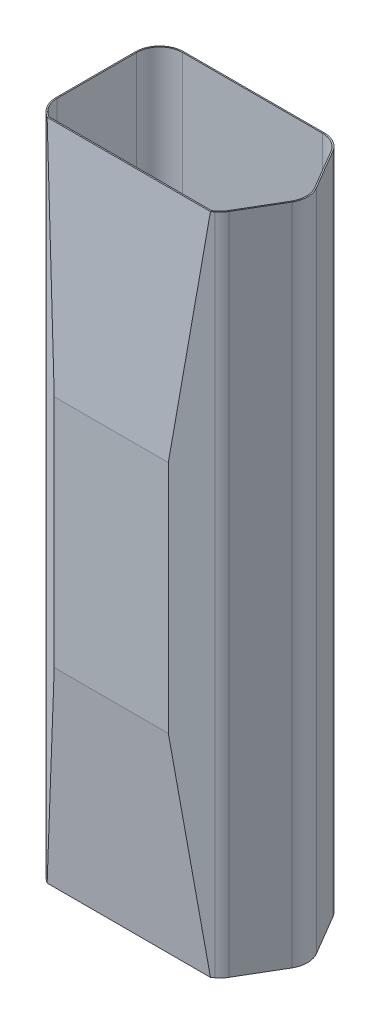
SolidWorks part; units mm, degrees
ref_plane "Front" through (0, 0, 0) normal (0, 0, 1) x (1, 0, 0)
ref_plane "Top" through (0, 0, 0) normal (0, 1, 0) x (1, 0, 0)
ref_plane "Right" through (0, 0, 0) normal (1, 0, 0) x (0, 0, -1)
sketch "Sketch1" plane through (0, 0, 0) normal (0, 1, 0) x (-1, 0, 0)
  line L0 (-155.2995, -11.0503) -> (-146.0495, -26.7824)
  line L1 (-155.2995, -1.8003) -> (-146.0495, 13.9318)
  line L2 (-73.5584, -22.1574) -> (-73.5584, 9.3068)
  line L3 (-155.7155, -1.5557) -> (-146.4655, 14.1764)
  line L4 (-88.1234, 24.4318) -> (-133.1234, 24.4318)
  line L6 (-73.0758, 9.3068) -> (-73.0758, -17.1218) construction
  line L7 (-157.041, -6.4253) -> (-157.041, 19.0815) construction
  line L8 (-73.0758, 2.661) -> (-157.041, 2.661) construction
  line L9 (-115.0584, 2.661) -> (-115.0584, 31.1081) construction
  line L10 (-73.0758, -22.1574) -> (-73.0758, 9.3068)
  line L12 (-21.6659, 107.8181) -> (-96.4392, 16.9583) construction
  line L13 (-24.5462, 105.0776) -> (-97.4724, 16.4622) construction
  line L14 (-24.5462, 105.0776) -> (-143.6244, 16.6322) construction
  line L15 (-21.6659, 107.8181) -> (-143.9121, 17.0197) construction
  line L16 (-97.4724, 16.4622) -> (-77.368, 16.7238) construction
  line L17 (-96.4392, 16.9583) -> (-77.218, 17.2084) construction
  line L18 (-117.6364, -13.1098) -> (-117.6364, 18.4318) construction
  line L19 (-155.2995, -11.0503) -> (-82.6834, -31.2824) construction
  line L20 (-155.6139, -11.4637) -> (-82.7502, -31.7648) construction
  line L21 (-133.1234, 24.4318) -> (-88.1234, 24.4318) construction
  line L22 (-138.1834, -31.2824) -> (-82.6834, -31.2824)
  line L23 (-77.368, 16.7238) -> (-88.1234, 24.4318)
  line L24 (-82.7502, -31.7648) -> (-138.4341, -31.7648)
  line L25 (-155.6139, -11.4637) -> (-146.3351, -27.2448)
  line L26 (-143.6244, 16.6322) -> (-133.1234, 24.4318)
  line L27 (-77.218, 17.2084) -> (-88.0061, 24.9398)
  line L28 (-88.0061, 24.9398) -> (-133.2489, 24.9398)
  line L29 (-133.2489, 24.9398) -> (-143.9121, 17.0197)
  arc A0 (-146.4655, 14.1764) -> (-143.9121, 17.0197) centre (-138.1834, 9.3068) cw
  arc A1 (-73.0758, 9.3068) -> (-77.218, 17.2084) centre (-82.6834, 9.3068) ccw
  arc A2 (-146.0495, 13.9318) -> (-143.6244, 16.6322) centre (-138.1834, 9.3068) cw
  arc A3 (-73.5584, 9.3068) -> (-77.368, 16.7238) centre (-82.6834, 9.3068) ccw
  circle A4 centre (-147.4334, -6.4253) radius 9.125 construction
  circle A5 centre (-138.1834, -22.1574) radius 9.125 construction
  circle A6 centre (-138.1834, 9.3068) radius 9.125 construction
  arc A7 (-155.2995, -1.8003) -> (-155.2995, -11.0503) centre (-147.4334, -6.4253) ccw construction
  arc A8 (-155.2995, -1.8003) -> (-155.2995, -11.0503) centre (-147.4334, -6.4253) ccw
  arc A9 (-82.6834, -31.2824) -> (-73.5584, -22.1574) centre (-82.6834, -22.1574) ccw
  arc A10 (-82.7502, -31.7648) -> (-73.0758, -22.1574) centre (-82.6834, -22.1574) ccw
  arc A11 (-155.7155, -1.5557) -> (-155.6139, -11.4637) centre (-147.4334, -6.4253) ccw
  circle A12 centre (-82.6834, 9.3068) radius 9.125 construction
  circle A13 centre (-82.6834, -22.1574) radius 9.125 construction
  arc A14 (-82.6834, -31.2824) -> (-73.5584, -22.1574) centre (-82.6834, -22.1574) ccw construction
  arc A15 (-73.0758, 9.3068) -> (-77.218, 17.2084) centre (-82.6834, 9.3068) ccw construction
  arc A16 (-138.1834, -31.2824) -> (-146.0495, -26.7824) centre (-138.1834, -22.1574) cw
  circle A17 centre (-82.6834, -22.1574) radius 9.125 construction
  arc A18 (-146.3351, -27.2448) -> (-138.4341, -31.7648) centre (-138.4341, -22.5993) ccw
  point P47 (-117.6364, 2.661)
  dimension "D1" = 0.4826
  dimension "D2" = 0.5485
  dimension "D3" = 0.508
extrude "Boss-Extrude1" add sketch "Sketch1" along normal up to surface (263 mm away)
sketch "Sketch4" plane through (0, 0, 0) normal (1, 0, 0) x (0, 0, -1)
  line L1 (-44.3701, 269.3259) -> (-17.3118, 269.3259)
  line L2 (-44.3701, 269.3259) -> (-44.3701, 175.55)
  line L3 (-44.3701, 175.55) -> (-17.3118, 175.55)
  line L4 (-17.3118, 269.3259) -> (-17.3118, 175.55)
  line L6 (-52.7293, -9.579) -> (-17.3118, -9.579)
  line L7 (-52.7293, -9.579) -> (-52.7293, 82.55)
  line L8 (-52.7293, 82.55) -> (-17.3118, 82.55)
  line L9 (-17.3118, -9.579) -> (-17.3118, 82.55)
  line L10 (-13.9318, 263) -> (1.8003, 263) construction
  line L11 (-24.4318, 169.2) -> (-18.4318, 169.2) construction
  line L12 (-24.4318, 88.9) -> (-18.4318, 88.9) construction
  line L13 (-24.4318, 88.9) -> (-18.4318, 88.9) construction
  point P12 (-6.0658, 263)
  point P15 (-21.4318, 88.9)
  dimension "D1" = 6.35
  dimension "D2" = 6.35
extrude "Cut-Extrude1" cut sketch "Sketch4" against normal through all both and the other way through all
sketch "Sketch5" plane through (0, 175.55, 0) normal (0, 1, 0) x (1, 0, 0)
  line L16 (143.5188, -17.3118) -> (142.7094, -17.3118)
  line L17 (142.7094, -17.3118) -> (133.1234, -24.4318)
  line L18 (133.1234, -24.4318) -> (88.1234, -24.4318)
  line L19 (88.1234, -24.4318) -> (78.1885, -17.3118)
  line L20 (143.5188, -17.3118) -> (142.7094, -17.3118)
  line L21 (77.3623, -17.3118) -> (88.0061, -24.9398)
  line L22 (88.0061, -24.9398) -> (133.2489, -24.9398)
  line L23 (133.2489, -24.9398) -> (143.5188, -17.3118)
  line L24 (78.1885, -17.3118) -> (77.3623, -17.3118)
  line L25 (142.7094, -17.3118) -> (133.1234, -24.4318)
  line L26 (133.1234, -24.4318) -> (88.1234, -24.4318)
  line L27 (88.1234, -24.4318) -> (78.1885, -17.3118)
  line L28 (78.1885, -17.3118) -> (77.3623, -17.3118)
  line L29 (77.3623, -17.3118) -> (88.0061, -24.9398)
  line L30 (88.0061, -24.9398) -> (133.2489, -24.9398)
  line L31 (133.2489, -24.9398) -> (143.5188, -17.3118)
  dimension "D1" = 0
sketch "Sketch6" plane through (0, 263, 0) normal (0, 1, 0) x (1, 0, 0)
  line L0 (77.3623, -17.3118) -> (143.5188, -17.3118)
  line L1 (77.3623, -17.3118) -> (78.0711, -17.8198)
  line L2 (78.0711, -17.8198) -> (142.8349, -17.8198)
  line L3 (142.8349, -17.8198) -> (143.5188, -17.3118)
  line L5 (143.5188, -17.3118) -> (143.9121, -17.0197) construction
  line L6 (77.218, -17.2084) -> (77.3623, -17.3118) construction
  dimension "D1" = 0.508
loft "Loft2" add profiles "Sketch6", "Sketch5"
sketch "Sketch7" plane through (0, 82.55, 0) normal (0, -1, 0) x (1, 0, 0)
  line L16 (143.5188, 17.3118) -> (133.2489, 24.9398)
  line L17 (133.2489, 24.9398) -> (88.0061, 24.9398)
  line L18 (88.0061, 24.9398) -> (77.3623, 17.3118)
  line L19 (77.3623, 17.3118) -> (78.1885, 17.3118)
  line L20 (78.1885, 17.3118) -> (88.1234, 24.4318)
  line L21 (88.1234, 24.4318) -> (133.1234, 24.4318)
  line L22 (133.1234, 24.4318) -> (142.7094, 17.3118)
  line L23 (77.3623, 17.3118) -> (78.1885, 17.3118)
  line L24 (143.5188, 17.3118) -> (133.2489, 24.9398)
  line L25 (133.2489, 24.9398) -> (88.0061, 24.9398)
  line L26 (88.0061, 24.9398) -> (77.3623, 17.3118)
  line L27 (142.7094, 17.3118) -> (143.5188, 17.3118)
  line L28 (78.1885, 17.3118) -> (88.1234, 24.4318)
  line L29 (88.1234, 24.4318) -> (133.1234, 24.4318)
  line L30 (133.1234, 24.4318) -> (142.7094, 17.3118)
  line L31 (142.7094, 17.3118) -> (143.5188, 17.3118)
  dimension "D1" = 0
sketch "Sketch8" plane through (0, 0, 0) normal (0, -1, 0) x (1, 0, 0)
  line L0 (77.3623, 17.3118) -> (143.5188, 17.3118)
  line L1 (143.5188, 17.3118) -> (142.8349, 17.8198)
  line L2 (142.8349, 17.8198) -> (78.0711, 17.8198)
  line L3 (78.0711, 17.8198) -> (77.3623, 17.3118)
  line L5 (77.218, 17.2084) -> (77.3623, 17.3118) construction
  line L6 (143.5188, 17.3118) -> (143.9121, 17.0197) construction
  dimension "D1" = 0.508
loft "Loft6" add profiles "Sketch7", "Sketch8"
